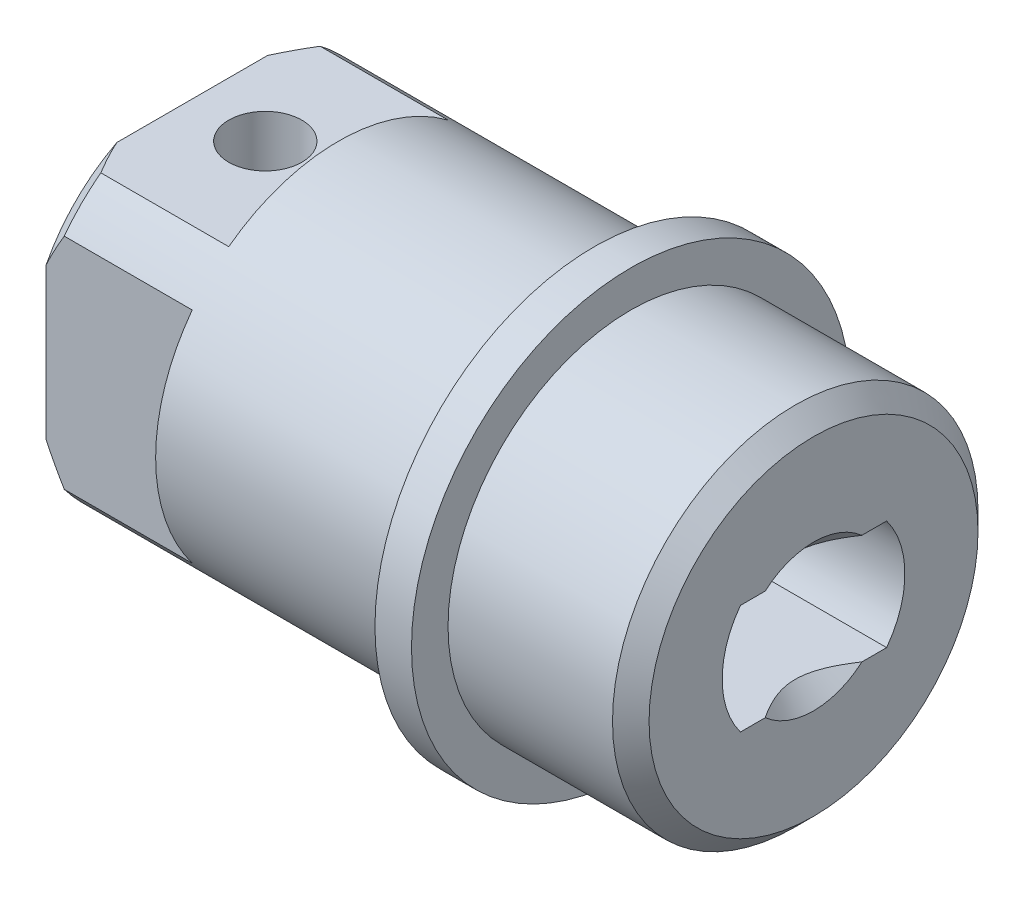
SolidWorks part; units mm, degrees
ref_plane "前视" through (0, 0, 0) normal (0, 0, 1) x (1, 0, 0)
ref_plane "上视" through (0, 0, 0) normal (0, 1, 0) x (1, 0, 0)
ref_plane "右视" through (0, 0, 0) normal (1, 0, 0) x (0, 0, -1)
sketch "草图1" plane through (0, 0, 0) normal (0, 0, 1) x (1, 0, 0)
  line L0 (0, 0) -> (44.0136, 0) construction
  line L1 (0, 0) -> (0, 5)
  line L2 (0, 5) -> (11, 5)
  line L3 (11, 5) -> (11, 6)
  line L4 (11, 6) -> (12, 6)
  line L5 (12, 6) -> (12, 5)
  line L6 (12, 5) -> (17, 5)
  line L7 (17, 5) -> (17, 1.5)
  line L8 (17, 1.5) -> (7, 1.5)
  line L9 (7, 1.5) -> (6.134, 0)
  line L10 (6.134, 0) -> (0, 0)
  point P3 (11.4256, 6.7927)
  dimension "D1" = 10
  dimension "D2" = 3
  dimension "D3" = 1
  dimension "D4" = 12
  dimension "D5" = 5
  dimension "D6" = 11
  dimension "D7" = 60
  dimension "D8" = 10
revolve "旋转1" add sketch "草图1" angle 360 about L0
chamfer "倒角1" distance 0.5 angle 45 3 edges at (17, 0, 1.5) (17, 0, 5) (0, 0, 5)
sketch "草图2" plane through (0, 0, 0) normal (-1, 0, 0) x (0, 0, 1)
  line L1 (-4, -4) -> (4, -4)
  line L2 (-4, -4) -> (-4, 4)
  line L3 (-4, 4) -> (4, 4)
  line L4 (4, -4) -> (4, 4)
  line L5 (-4, -4) -> (4, 4) construction
  line L6 (-4, 4) -> (4, -4) construction
  point P0 (0, 0)
  dimension "D1" = 8
extrude "切除-拉伸1" cut sketch "草图2" against normal blind 4 flip side to cut
sketch "草图3" plane through (0, 0, 0) normal (0, 1, 0) x (1, 0, 0)
  line L0 (0, 0) -> (6.4434, 0) construction
  line L2 (0, 4) -> (0, 2.0616) construction
  circle A0 centre (2, 0) radius 1
  dimension "D1" = 2
  dimension "D2" = 2
extrude "切除-拉伸2" cut sketch "草图3" against normal mid plane 24
sketch "草图4" plane through (17, 0, 0) normal (1, 0, 0) x (0, 0, -1)
  line L0 (-7.1097, 0) -> (7.4297, 0) construction
  line L1 (-2, 1.5) -> (2, 1.5)
  line L2 (-2, -1.5) -> (2, -1.5)
  arc A0 (-2, 1.5) -> (-2, -1.5) centre (0, 0) ccw
  arc A1 (2, -1.5) -> (2, 1.5) centre (0, 0) ccw
  point P7 (-1.8534, -1.6778)
  dimension "D1" = 2.5
  dimension "D2" = 3
extrude "切除-拉伸3" cut sketch "草图4" against normal blind 10
